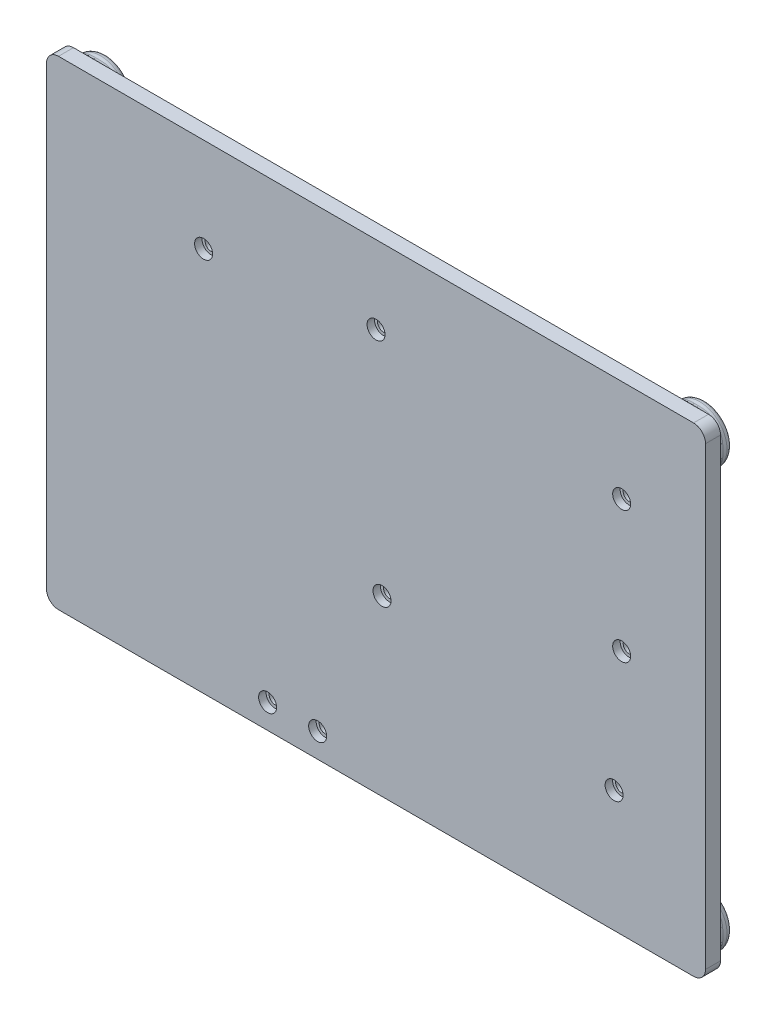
SolidWorks part; units mm, degrees
ref_plane "Front Plane" through (0, 0, 0) normal (0, 0, 1) x (1, 0, 0)
ref_plane "Top Plane" through (0, 0, 0) normal (0, 1, 0) x (1, 0, 0)
ref_plane "Right Plane" through (0, 0, 0) normal (1, 0, 0) x (0, 0, -1)
sketch "Sketch1" plane through (0, 0, 0) normal (0, 0, 1) x (1, 0, 0)
  line L1 (-69.85, -50.8) -> (69.85, -50.8)
  line L2 (-69.85, -50.8) -> (-69.85, 50.8)
  line L3 (-69.85, 50.8) -> (69.85, 50.8)
  line L4 (69.85, -50.8) -> (69.85, 50.8)
  line L5 (-69.85, -50.8) -> (69.85, 50.8) construction
  line L6 (-69.85, 50.8) -> (69.85, -50.8) construction
  circle A0 centre (1.27, -13.97) radius 1.016 construction
  circle A1 centre (52.07, 1.27) radius 1.016 construction
  circle A2 centre (52.07, 29.21) radius 1.016 construction
  circle A3 centre (0, 34.29) radius 1.016 construction
  circle A4 centre (50.4698, -25.0444) radius 1.016 construction
  circle A5 centre (-12.3726, -45.625) radius 1.016 construction
  circle A6 centre (-22.9826, -45.625) radius 1.016 construction
  circle A7 centre (-36.5506, 30.8356) radius 1.016 construction
  circle A8 centre (1.27, -13.97) radius 1.016 construction
  circle A9 centre (52.07, 1.27) radius 1.016 construction
  circle A10 centre (52.07, 29.21) radius 1.016 construction
  circle A11 centre (0, 34.29) radius 1.016 construction
  circle A12 centre (50.4698, -25.0444) radius 1.016 construction
  circle A13 centre (-12.3726, -45.625) radius 1.016 construction
  circle A14 centre (-22.9826, -45.625) radius 1.016 construction
  circle A15 centre (-36.5506, 30.8356) radius 1.016 construction
  circle A16 centre (-22.9826, -45.625) radius 1.27
  circle A17 centre (-12.3726, -45.625) radius 1.27
  circle A18 centre (50.4698, -25.0444) radius 1.27
  circle A19 centre (52.07, 1.27) radius 1.27
  circle A20 centre (52.07, 29.21) radius 1.27
  circle A21 centre (0, 34.29) radius 1.27
  circle A22 centre (1.27, -13.97) radius 1.27
  circle A23 centre (-36.5506, 30.8356) radius 1.27
  point P0 (0, 0)
  dimension "D3" = 101.6
  dimension "D4" = 139.7
  dimension "D1" = 0.254
  dimension "D2" = 0.254
extrude "Boss-Extrude1" add sketch "Sketch1" along normal blind 3.175
sketch "Sketch2" plane through (0, 0, 3.175) normal (0, 0, 1) x (1, 0, 0)
  circle A8 centre (-12.3726, -45.625) radius 1.905
  circle A9 centre (-22.9826, -45.625) radius 1.905
  circle A10 centre (1.27, -13.97) radius 1.905
  circle A11 centre (50.4698, -25.0444) radius 1.905
  circle A12 centre (52.07, 1.27) radius 1.905
  circle A13 centre (52.07, 29.21) radius 1.905
  circle A14 centre (0, 34.29) radius 1.905
  circle A15 centre (-36.5506, 30.8356) radius 1.905
  dimension "D1" = 3.81
extrude "Cut-Extrude1" cut sketch "Sketch2" against normal blind 1.5875
fillet "Fillet1" radius 2.54 4 edges at (-69.85, 50.8, 1.5875) (-69.85, -50.8, 1.5875) (69.85, 50.8, 1.5875) (69.85, -50.8, 1.5875)
sketch "Sketch4" plane through (0, 0, 0) normal (0, 0, -1) x (-1, 0, 0)
  circle A0 centre (-63.5, 44.45) radius 5.8293
  circle A1 centre (-63.5, -44.45) radius 5.8293
  circle A2 centre (63.5, -44.45) radius 5.8293
  circle A3 centre (63.5, 44.45) radius 5.8293
  circle A4 centre (-63.5, 44.45) radius 5.6515 construction
  dimension "D1" = 0.1778
extrude "Boss-Extrude2" add sketch "Sketch4" along normal blind 3.175
fillet "Fillet2" radius 1.27 8 edges at (57.6707, 44.45, -3.175) (-69.3293, 44.45, 0) (-69.3293, 44.45, -3.175) (-69.3293, -44.45, -3.175) (-69.3293, -44.45, 0) (57.6707, -44.45, 0) (57.6707, -44.45, -3.175) (57.6707, 44.45, 0)
